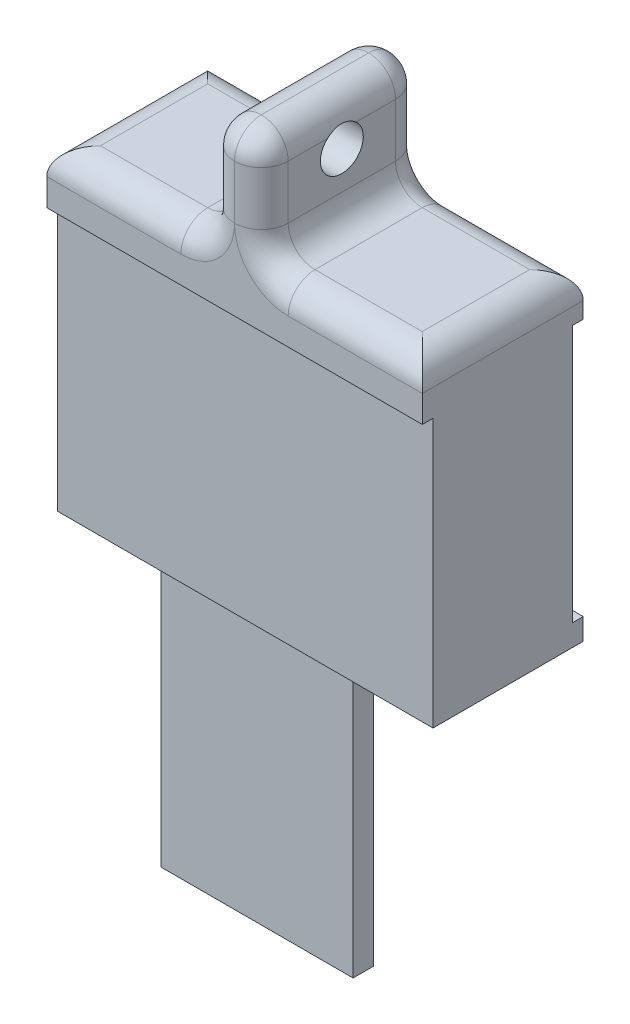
SolidWorks part; units mm, degrees
ref_plane "정면" through (0, 0, 0) normal (0, 0, 1) x (1, 0, 0)
ref_plane "윗면" through (0, 0, 0) normal (0, 1, 0) x (1, 0, 0)
ref_plane "우측면" through (0, 0, 0) normal (1, 0, 0) x (0, 0, -1)
sketch "스케치1" plane through (0, 0, 0) normal (0, 0, 1) x (1, 0, 0)
  line L1 (-17.5, -15) -> (17.5, -15)
  line L2 (-17.5, -15) -> (-17.5, 15)
  line L3 (-17.5, 15) -> (17.5, 15)
  line L4 (17.5, -15) -> (17.5, 15)
  line L5 (-17.5, -15) -> (17.5, 15) construction
  line L6 (-17.5, 15) -> (17.5, -15) construction
  point P0 (0, 0)
  dimension "D1" = 35
  dimension "D2" = 30
extrude "보스-돌출1" add sketch "스케치1" along normal blind 15
sketch "스케치3" plane through (0, -15, 0) normal (0, -1, 0) x (1, 0, 0)
  line L0 (17.5, 15) -> (17.5, 0) construction
  point P0 (9.5, 7.5)
  point P3 (17.5, 7.5)
  dimension "D1" = 8
sketch "스케치6" plane through (0, -15, 0) normal (0, -1, 0) x (-1, 0, 0)
  line L0 (1, -11) -> (8.95, -11)
  line L2 (1, -11) -> (1, -6.1)
  line L3 (1, -6.1) -> (-0.9, -6.1)
  line L4 (-0.9, -11) -> (-0.9, -6.1)
  line L5 (17.5, -15) -> (17.5, 0) construction
  line L6 (-8.95, -11) -> (-0.9, -11)
  line L7 (17.5, -15) -> (-17.5, -15) construction
  line L8 (-8.95, -11) -> (-8.95, -12.9)
  line L9 (-8.95, -12.9) -> (8.95, -12.9)
  line L10 (8.95, -11) -> (8.95, -12.9)
  point P12 (0, -12.9)
  dimension "D1" = 1.9
  dimension "D2" = 4.9
  dimension "D3" = 2.1
  dimension "D4" = 16.5
  dimension "D5" = 17.9
  dimension "D6" = 1.9
sketch "스케치7" plane through (0, 15, 0) normal (0, 1, 0) x (1, 0, 0)
  line L8 (17.5, 0) -> (-17.5, 0)
  line L9 (-17.5, 0) -> (-17.5, -15)
  line L10 (-17.5, -15) -> (17.5, -15)
  line L11 (17.5, -15) -> (17.5, 0)
  line L12 (17.5, 0) -> (-17.5, 0)
  line L13 (-17.5, 0) -> (-17.5, -15)
  line L14 (-17.5, -15) -> (17.5, -15)
  line L15 (17.5, -15) -> (17.5, 0)
  dimension "D1" = 0
extrude "보스-돌출2" add sketch "스케치7" along normal blind 10
extrude "보스-돌출3" add sketch "스케치6" along normal blind 25
sketch "스케치12" plane through (0, 0, 15) normal (0, 0, 1) x (1, 0, 0)
  line L0 (17.5, -15) -> (17.5, 17) construction
  line L1 (-17.5, -15) -> (17.5, -15)
  line L2 (-17.5, -15) -> (-17.5, 10)
  line L3 (-17.5, 10) -> (17.5, 10)
  line L4 (17.5, -15) -> (17.5, 10)
  dimension "D1" = 25
extrude "컷-돌출4" cut sketch "스케치12" against normal blind 1
sketch "스케치14" plane through (0, 0, 0) normal (0, 0, -1) x (-1, 0, 0)
  line L0 (-17.5, -15) -> (-17.5, 25) construction
  line L1 (-15.5, 11) -> (15.5, 11)
  line L2 (-15.5, 11) -> (-15.5, -13)
  line L3 (-15.5, -13) -> (15.5, -13)
  line L4 (15.5, 11) -> (15.5, -13)
  line L5 (17.5, 25) -> (17.5, -15) construction
  line L6 (17.5, -15) -> (-17.5, -15) construction
  dimension "D1" = 2
  dimension "D2" = 2
  dimension "D3" = 2
  dimension "D4" = 24
extrude "컷-돌출6" cut sketch "스케치14" against normal blind 10
sketch "스케치13" plane through (0, -15, 0) normal (0, -1, 0) x (1, 0, 0)
  line L0 (17.5, 15) -> (-17.5, 15) construction
  line L1 (-17.5, 14) -> (-17.5, 0) construction
  circle A0 centre (-9.5, 5) radius 2.5
  dimension "D3" = 5
  dimension "D1" = 10
  dimension "D2" = 8
extrude "컷-돌출5" cut sketch "스케치13" against normal up to surface (2 mm away)
sketch "스케치18" plane through (0, 0, 0) normal (0, 0, -1) x (-1, 0, 0)
  line L0 (-17.5, -15) -> (-17.5, 25) construction
  line L1 (-17.5, 11) -> (17.5, 11)
  line L2 (-17.5, 11) -> (-17.5, -13)
  line L3 (-17.5, -13) -> (17.5, -13)
  line L4 (17.5, 11) -> (17.5, -13)
  line L5 (17.5, 25) -> (17.5, -15) construction
  line L6 (15.5, 11) -> (-15.5, 11) construction
  line L7 (-15.5, -13) -> (15.5, -13) construction
extrude "컷-돌출10" cut sketch "스케치18" against normal blind 1
fillet "필렛6" radius 1 2 edges at (0.9, -27.5, 6.1) (-1, -27.5, 6.1)
fillet "필렛7" radius 1 2 edges at (-1, -27.5, 11) (0.9, -27.5, 11)
sketch "스케치21" plane through (17.5, 0, 0) normal (1, 0, 0) x (0, 0, -1)
  line L0 (0, 11) -> (0, 25) construction
  line L1 (-15, 25) -> (0, 25)
  line L2 (-15, 25) -> (-15, 15)
  line L3 (-15, 15) -> (0, 15)
  line L4 (0, 25) -> (0, 15)
  dimension "D1" = 10
extrude "컷-돌출13" cut sketch "스케치21" against normal blind 15
mirror "대칭 복사1" about plane through (0, 0, 0) normal (1, 0, 0) of "컷-돌출13"
sketch "스케치22" plane through (-2.5, 0, 0) normal (-1, 0, 0) x (0, 0, 1)
  line L0 (0, 25) -> (15, 25) construction
  circle A0 centre (7.5, 21) radius 2
  point P4 (7.5, 25)
  dimension "D1" = 4
  dimension "D2" = 4
extrude "컷-돌출14" cut sketch "스케치22" against normal through all
fillet "필렛8" radius 2.5 16 edges at (0, 25, 0) (2.5, 20, 15) (10, 15, 15) (2.5, 25, 7.5) (2.5, 20, 0) (2.5, 15, 7.5) (10, 15, 0) (17.5, 15, 7.5) (0, 25, 15) (-17.5, 15, 7.5) (-10, 15, 15) (-10, 15, 0) (-2.5, 20, 15) (-2.5, 15, 7.5) (-2.5, 20, 0) (-2.5, 25, 7.5)
sketch "스케치23" plane through (0, -15, 0) normal (0, -1, 0) x (-1, 0, 0)
  line L0 (-17.5, -15) -> (17.5, -15) construction
  line L1 (-17.5, -14) -> (-17.5, 0) construction
  circle A0 centre (-9.5, -5) radius 2.5
  dimension "D1" = 5
  dimension "D2" = 10
  dimension "D3" = 8
extrude "컷-돌출15" cut sketch "스케치23" against normal up to surface (2 mm away)
